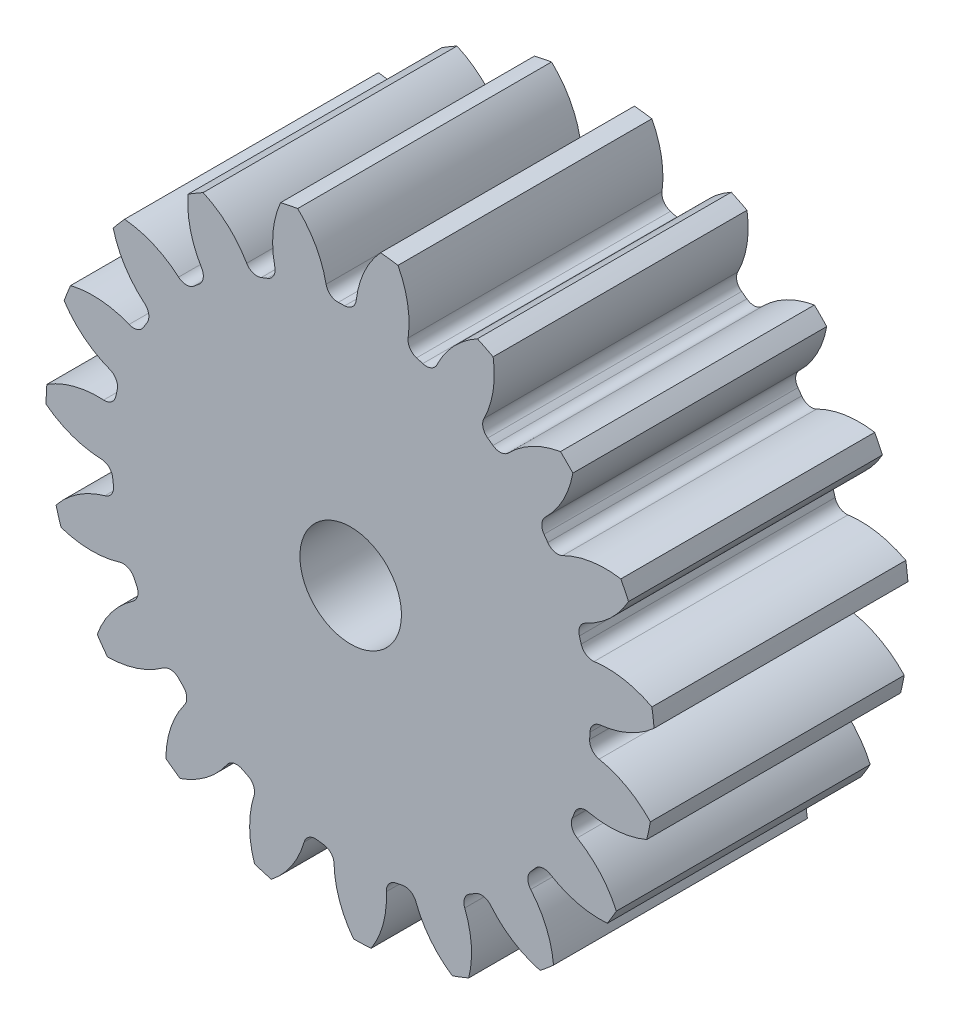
SolidWorks part; units mm, degrees
ref_plane "Front" through (0, 0, 0) normal (0, 0, 1) x (1, 0, 0)
ref_plane "Top" through (0, 0, 0) normal (0, 1, 0) x (1, 0, 0)
ref_plane "Right" through (0, 0, 0) normal (1, 0, 0) x (0, 0, -1)
sketch "Sketch3" plane through (0, 0, 0) normal (0, 0, 1) x (1, 0, 0)
  circle A0 centre (0, 0) radius 106.68
  dimension "od" = 213.36
extrude "gearBody" add sketch "Sketch3" along normal blind 88.9
sketch "Sketch2" plane through (0, 0, 0) normal (0, 0, 1) x (1, 0, 0)
  line L0 (0, 0) -> (83.7951, 34.7091) construction
  line L1 (105.354, -19.6433) -> (0, 0) construction
  line L2 (0, 0) -> (36.3143, 0) construction
  line L3 (96.4498, 3.6815) -> (95.7443, -12.2123) construction
  line L5 (96.097, -4.2654) -> (0, 0) construction
  line L7 (0, 0) -> (90.6991, 0) construction
  arc A0 (90.6789, 1.9148) -> (90.1527, -9.9412) centre (0, 0) ccw construction
  arc A1 (106.2274, 9.8164) -> (104.9399, -19.1894) centre (0, 0) ccw construction
  arc A2 (96.4498, 3.6815) -> (95.7443, -12.2123) centre (0, 0) ccw construction
  arc A3 (83.6795, -4.8512) -> (83.7802, -2.5817) centre (0, 0) ccw
  arc A4 (105.354, -19.6433) -> (86.9929, -9.1446) centre (80.3904, -41.9966) ccw
  arc A5 (105.354, -19.6433) -> (106.68, 10.2319) centre (0, 0) ccw
  arc A6 (106.68, 10.2319) -> (87.461, 1.4012) centre (83.7951, 34.7091) cw
  arc A7 (83.7802, -2.5817) -> (87.461, 1.4012) centre (87.9134, -2.7091) cw
  arc A8 (86.9929, -9.1446) -> (83.6795, -4.8512) centre (87.8077, -5.0905) cw
  point P6 (106.68, 10.2319)
  point P22 (105.354, -19.6433)
  dimension "baseDia" = 181.3983
  dimension "od" = 213.36
  dimension "pd" = 193.04
  dimension "rd" = 167.64
  dimension "rFillet" = 4.1351
  dimension "pointX" = 106.68
  dimension "pointY" = 10.2319
  dimension "CTT" = 15.8937
  dimension "flankCenterAngle" = 22.5
extrude "toothCut" cut sketch "Sketch2" along normal through all
pattern_circular "CirPattern1" count 19 over 360 about axis through (0, 0, 0) along (0, 0, 1) of "toothCut"
sketch "hub1Dia" plane through (0, 0, 0) normal (0, 0, -1) x (-1, 0, 0)
  circle A0 centre (0, 0) radius 12.7
  dimension "hub1Dia" = 25.4
sketch "hub2Dia" plane through (0, 0, 88.9) normal (0, 0, 1) x (1, 0, 0)
  circle A0 centre (0, 0) radius 12.7
  dimension "hub2dia" = 25.4
sketch "boreDia" plane through (0, 0, 0) normal (0, 0, 1) x (1, 0, 0)
  circle A0 centre (0, 0) radius 17.78
  dimension "boreDia" = 35.56
extrude "bore" cut sketch "boreDia" against normal mid plane 25400
